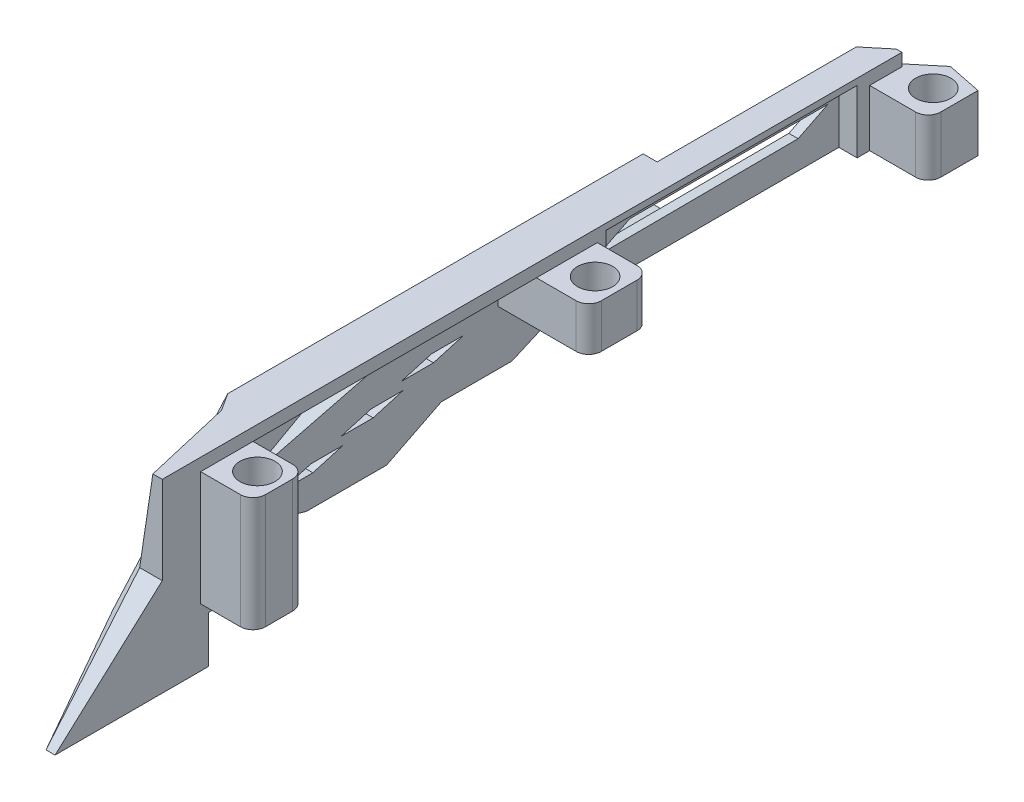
SolidWorks part; units mm, degrees
other "<侧板V4>-<切除-拉伸165>"
ref_plane "前视基准面" through (0, 0, 0) normal (0, 0, 1) x (1, 0, 0)
ref_plane "上视基准面" through (0, 0, 0) normal (0, 1, 0) x (1, 0, 0)
ref_plane "右视基准面" through (0, 0, 0) normal (1, 0, 0) x (0, 0, -1)
mirrored part "侧板V4_镜向"
